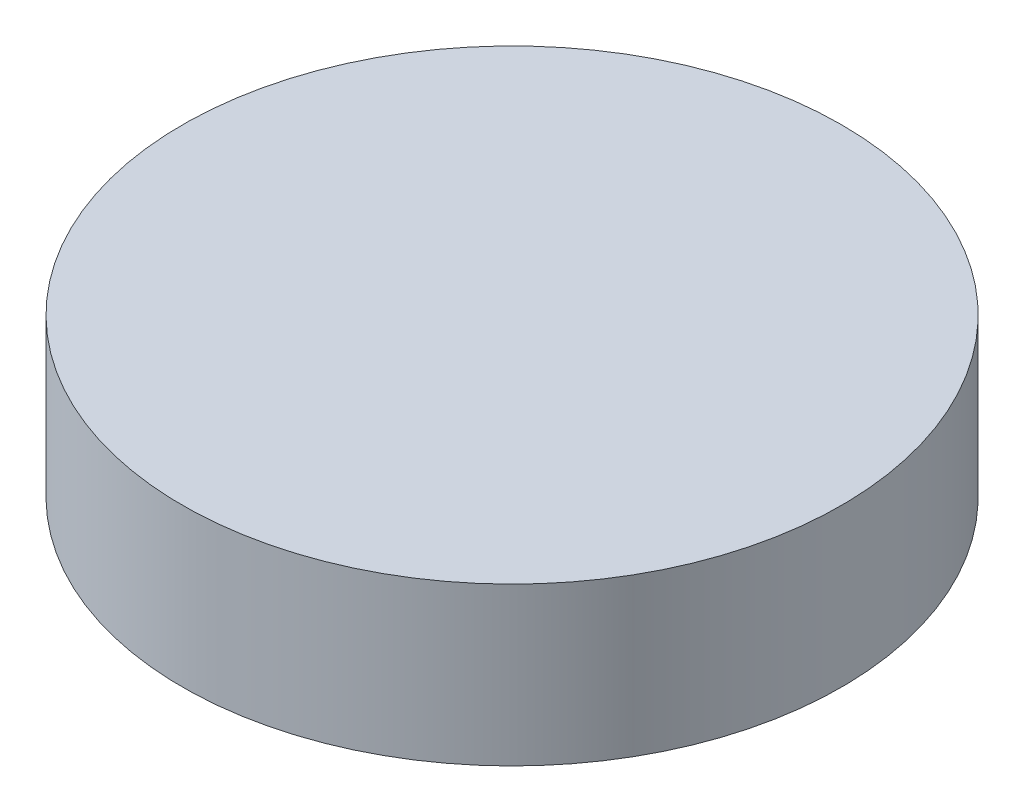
SolidWorks part; units mm, degrees
ref_plane "前视基准面" through (0, 0, 0) normal (0, 0, 1) x (1, 0, 0)
ref_plane "上视基准面" through (0, 0, 0) normal (0, 1, 0) x (1, 0, 0)
ref_plane "右视基准面" through (0, 0, 0) normal (1, 0, 0) x (0, 0, -1)
sketch "草图1" plane through (0, 0, 0) normal (0, 0, 1) x (1, 0, 0)
  line L0 (0, 0) -> (0, 528.9135) construction
  line L1 (0, 380) -> (565, 380)
  line L2 (565, 380) -> (565, 110)
  line L3 (565, 110) -> (360, 0)
  line L4 (360, 0) -> (0, 0)
  line L5 (0, 0) -> (0, 380)
  dimension "D1" = 270
  dimension "D2" = 110
  dimension "D3" = 1130
  dimension "D4" = 720
revolve "旋转1" add sketch "草图1" angle 360 about L0
